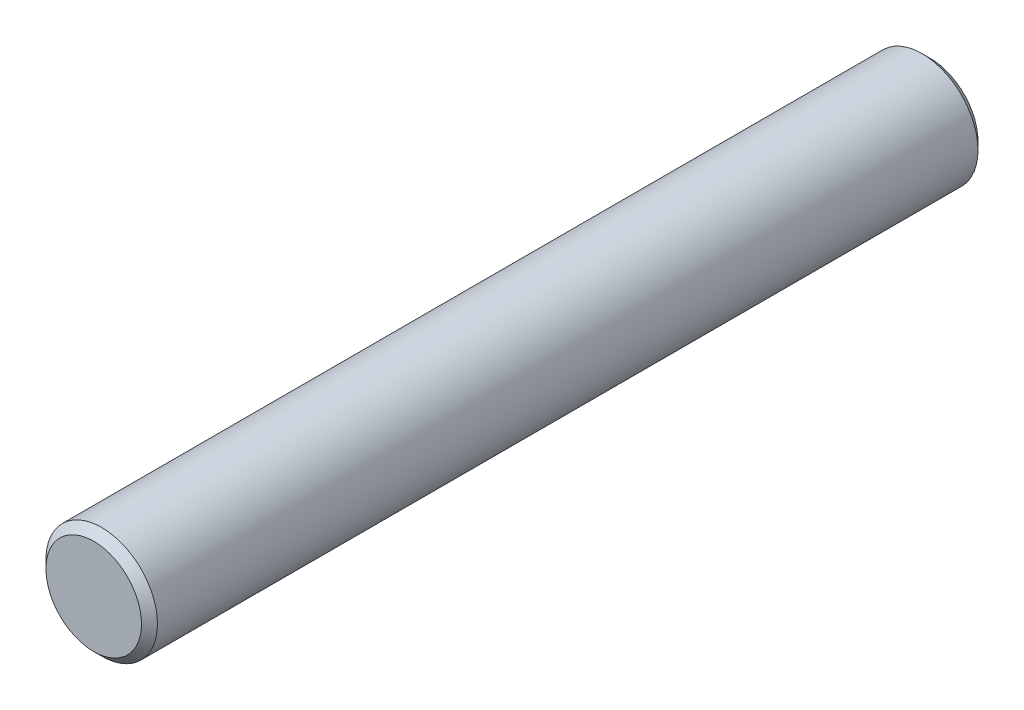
SolidWorks part; units mm, degrees
ref_plane "Face" through (0, 0, 0) normal (0, 0, 1) x (1, 0, 0)
ref_plane "Dessus" through (0, 0, 0) normal (0, 1, 0) x (1, 0, 0)
ref_plane "Droite" through (0, 0, 0) normal (1, 0, 0) x (0, 0, -1)
sketch "Esquisse1" plane through (0, 0, 0) normal (0, 0, 1) x (1, 0, 0)
  circle A0 centre (0, 0) radius 14
  dimension "D1" = 28
extrude "Base-Extrusion" add sketch "Esquisse1" along normal blind 210
chamfer "Chanfrein1" distance 2 angle 45
